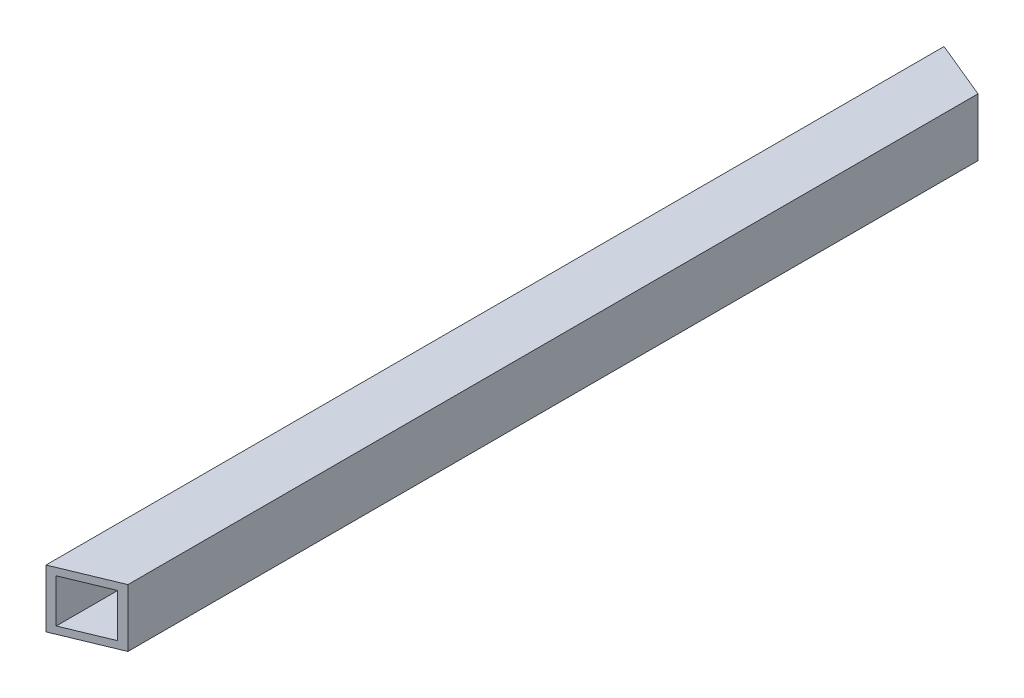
SolidWorks part; units mm, degrees
ref_plane "Front Plane" through (0, 0, 0) normal (0, 0, 1) x (1, 0, 0)
ref_plane "Top Plane" through (0, 0, 0) normal (0, 1, 0) x (1, 0, 0)
ref_plane "Right Plane" through (0, 0, 0) normal (1, 0, 0) x (0, 0, -1)
sketch "Sketch1" plane through (0, 0, 0) normal (0, 0, 1) x (1, 0, 0)
  line L1 (-9.525, -9.525) -> (9.525, -9.525)
  line L2 (-9.525, -9.525) -> (-9.525, 9.525)
  line L3 (-9.525, 9.525) -> (9.525, 9.525)
  line L4 (9.525, -9.525) -> (9.525, 9.525)
  line L5 (-9.525, -9.525) -> (9.525, 9.525) construction
  line L6 (-9.525, 9.525) -> (9.525, -9.525) construction
  line L7 (-12.7, -12.7) -> (12.7, -12.7)
  line L8 (-12.7, -12.7) -> (-12.7, 12.7)
  line L9 (-12.7, 12.7) -> (12.7, 12.7)
  line L10 (12.7, -12.7) -> (12.7, 12.7)
  line L11 (-12.7, -12.7) -> (12.7, 12.7) construction
  line L12 (-12.7, 12.7) -> (12.7, -12.7) construction
  point P0 (0, 0)
  point P6 (0, 0)
  dimension "D1" = 25.4
  dimension "D2" = 25.4
  dimension "D3" = 3.175
  dimension "D4" = 3.175
extrude "Boss-Extrude1" add sketch "Sketch1" along normal mid plane 393.7
sketch "Sketch2" plane through (0, 12.7, 0) normal (0, 1, 0) x (1, 0, 0)
  line L0 (12.7, 186.329) -> (-12.7, 196.85)
  line L1 (-12.7, -196.85) -> (-12.7, 196.85) construction
  line L2 (-12.7, 196.85) -> (-12.7, -196.85)
  line L3 (-12.7, -196.85) -> (12.7, -186.329)
  line L4 (12.7, -186.329) -> (12.7, 186.329)
  line L5 (12.7, -196.85) -> (12.7, 196.85) construction
  dimension "D1" = 67.5
  dimension "D2" = 67.5
extrude "Cut-Extrude1" cut sketch "Sketch2" against normal through all flip side to cut
